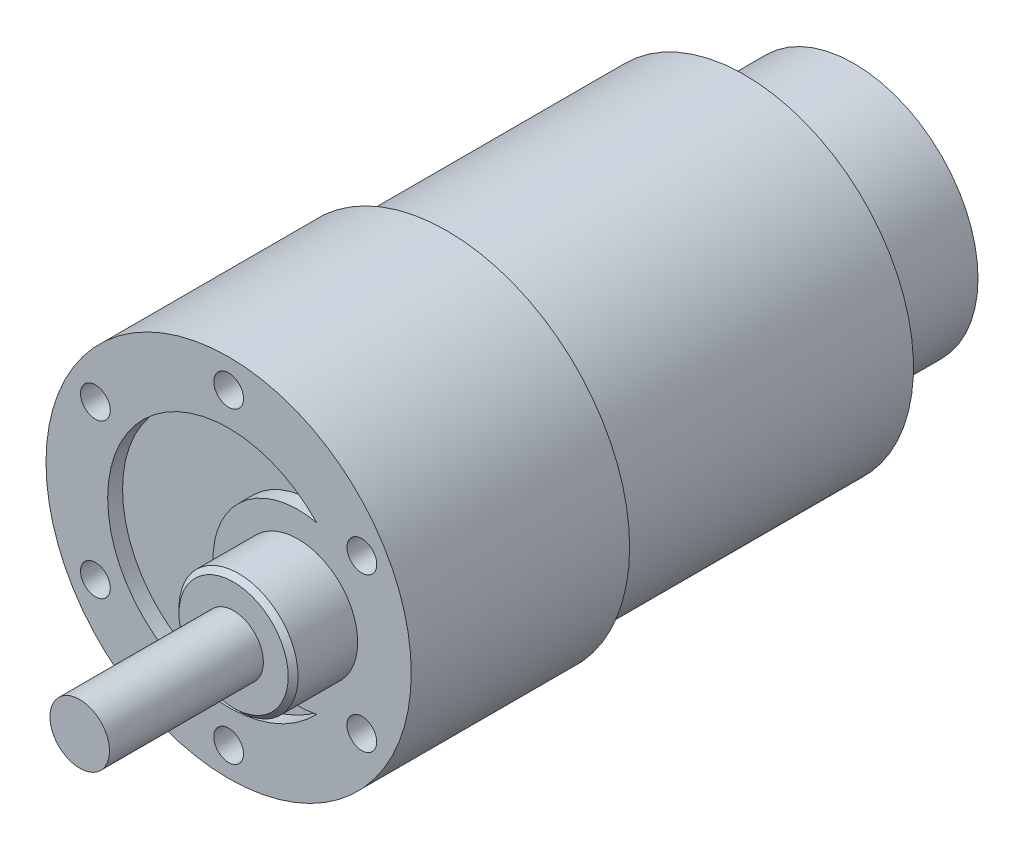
SolidWorks part; units mm, degrees
ref_plane "Front Plane" through (0, 0, 0) normal (0, 0, 1) x (1, 0, 0)
ref_plane "Top Plane" through (0, 0, 0) normal (0, 1, 0) x (1, 0, 0)
ref_plane "Right Plane" through (0, 0, 0) normal (1, 0, 0) x (0, 0, -1)
ref_plane "Plane1" through (0, 0, 0) normal (0, -1, 0) x (1, 0, 0)
sketch "Sketch1" plane through (0, 0, 0) normal (0, -1, 0) x (1, 0, 0)
  line L0 (18.4, 52) -> (0, 52)
  line L1 (0, 52) -> (0, 29)
  line L2 (0, 29) -> (17, 29)
  line L3 (16, 30) -> (18.4, 30)
  line L4 (18.4, 30) -> (18.4, 52)
  line L5 (0, 52) -> (0, 29) construction
  arc A0 (17, 29) -> (16, 30) centre (16, 29) ccw
revolve "Revolve1" add sketch "Sketch1" angle 360 about L5
sketch "Sketch2" plane through (0, 0, 29) normal (0, 0, -1) x (-1, 0, 0)
  circle A0 centre (0, 0) radius 17
extrude "Boss-Extrude1" add sketch "Sketch2" along normal blind 29
sketch "Sketch3" plane through (0, 0, 0) normal (0, 0, -1) x (-1, 0, 0)
  circle A0 centre (0, 0) radius 12.5
extrude "Boss-Extrude2" add sketch "Sketch3" along normal blind 11
sketch "Sketch4" plane through (0, 0, 52) normal (0, 0, 1) x (1, 0, 0)
  arc A0 (8.8681, 8.3597) -> (8.8681, -8.3597) centre (0, 0) ccw
  arc A1 (8.8681, -8.3597) -> (8.8681, 8.3597) centre (7, 0) cw
extrude "Cut-Extrude1" cut sketch "Sketch4" against normal blind 1.5
sketch "Sketch5" plane through (0, 0, 0) normal (0, -1, 0) x (1, 0, 0)
  line L0 (10, 74) -> (7, 74)
  line L1 (7, 74) -> (7, 52)
  line L2 (7, 52) -> (13, 52)
  line L3 (13, 52) -> (13, 58.5)
  line L4 (13, 58.5) -> (10, 58.5)
  line L5 (10, 58.5) -> (10, 74)
  line L6 (7, 74) -> (7, 52) construction
revolve "Revolve2" add sketch "Sketch5" angle 360 about L6
hole_wizard "Ø3.0 (3) Diameter Hole1" positions "Sketch7" profile "Sketch6" hole size "Ø3.0" standard "Ansi Metric"
sketch "Sketch7" plane through (0, 0, 52) normal (0, 0, 1) x (1, 0, 0)
  point P0 (-13.4234, 7.75)
  point P1 (-13.4234, -7.75)
  point P2 (0, -15.5)
  point P3 (13.4234, -7.75)
  point P4 (13.4234, 7.75)
  point P5 (0, 15.5)
sketch "Sketch6" plane through (-13.4234, 7.75, 52) normal (1, 0, 0) x (0, -1, 0)
  line L0 (0, 0) -> (0, 3)
  line L1 (0, 3) -> (1.5, 3)
  line L2 (1.5, 3) -> (1.5, 0)
  line L5 (1.5, 0) -> (0, 0)
  line L10 (0, 3) -> (-1.5, 3) construction
  line L11 (0, -6.35) -> (0, 107.95) construction
  dimension "Hole Dia." = 3
  dimension "Hole Depth" = 3
  dimension "Drill Angle" = 180
chamfer "Chamfer1" distance 0.5 angle 45 1 edges at (1, 0, 58.5)
